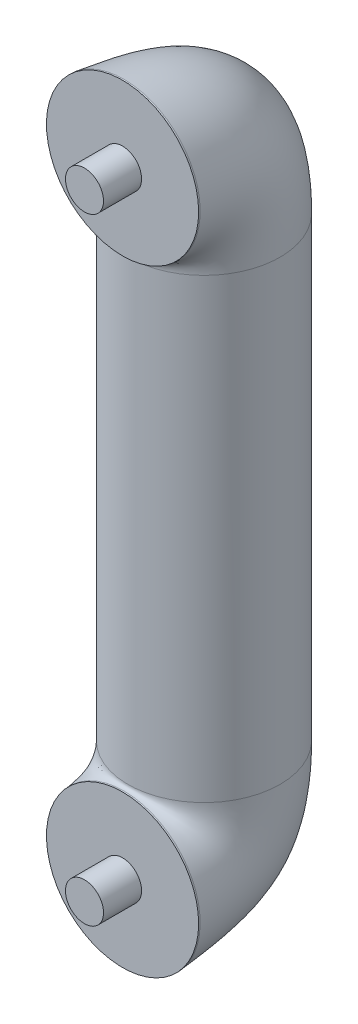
SolidWorks part; units mm, degrees
ref_plane "Ebene vorne" through (0, 0, 0) normal (0, 0, 1) x (1, 0, 0)
ref_plane "Ebene oben" through (0, 0, 0) normal (0, 1, 0) x (1, 0, 0)
ref_plane "Ebene rechts" through (0, 0, 0) normal (1, 0, 0) x (0, 0, -1)
sketch "Skizze1" plane through (0, 0, 0) normal (0, 0, 1) x (1, 0, 0)
  circle A0 centre (0, 0) radius 100
  dimension "D1" = 200
extrude "Aufsatz-Linear austragen1" add sketch "Skizze1" along normal blind 2
sketch "Skizze2" plane through (0, 0, 2) normal (0, 0, 1) x (1, 0, 0)
  circle A0 centre (0, 0) radius 25
  dimension "D1" = 50
extrude "Aufsatz-Linear austragen2" add sketch "Skizze2" along normal blind 50
ref_plane "Ebene1" through (0, 105, 0) normal (0, 1, 0) x (1, 0, 0)
sketch "Skizze4" plane through (0, 105, 0) normal (0, 1, 0) x (1, 0, 0)
  circle A0 centre (0, 105) radius 100
  dimension "D1" = 200
  dimension "D2" = 105
other "Begrenzung1"
sketch "Skizze5" plane through (0, 105, 0) normal (0, 1, 0) x (1, 0, 0)
  circle A1 centre (0, 105) radius 100 construction
  circle A2 centre (0, 105) radius 98
  circle A3 centre (0, 105) radius 98
  circle A4 centre (0, 105) radius 100
  dimension "D1" = 2
extrude "Aufsatz-Linear austragen3" add sketch "Skizze5" along normal blind 300
mirror "Spiegeln2" about plane through (0, 405, -105) normal (0, 1, 0)
